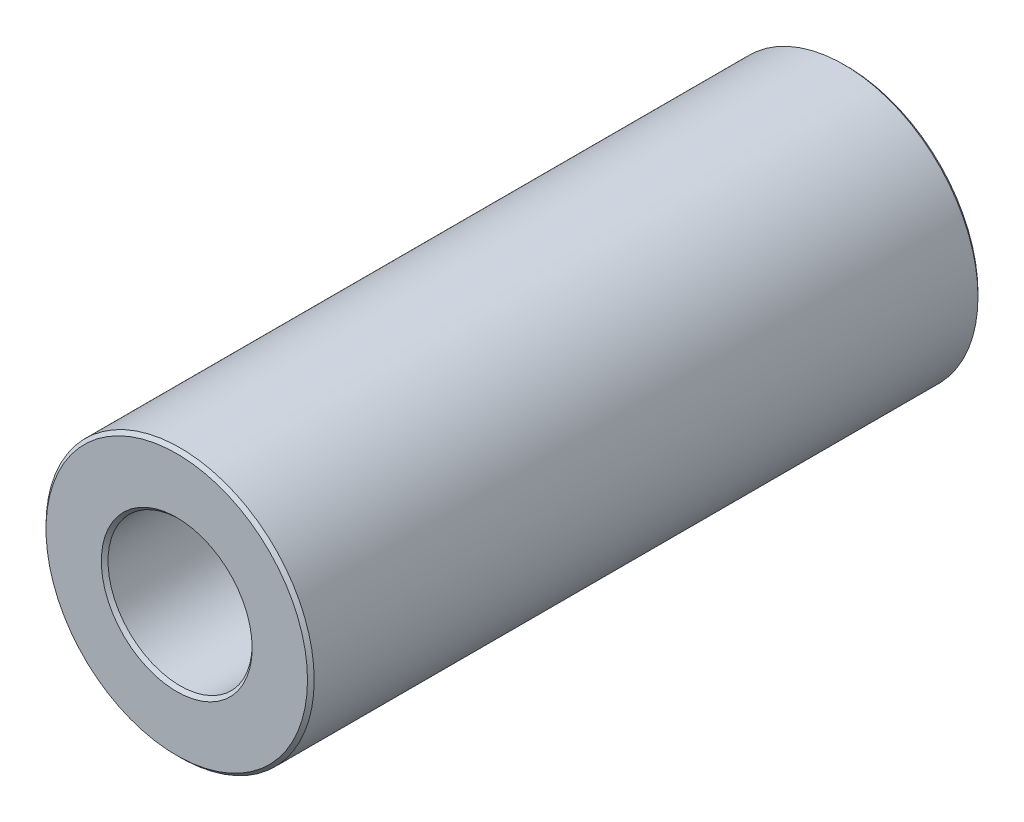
SolidWorks part; units mm, degrees
ref_plane "Front Plane" through (0, 0, 0) normal (0, 0, 1) x (1, 0, 0)
ref_plane "Top Plane" through (0, 0, 0) normal (0, 1, 0) x (1, 0, 0)
ref_plane "Right Plane" through (0, 0, 0) normal (1, 0, 0) x (0, 0, -1)
sketch "Sketch1" plane through (0, 0, 0) normal (0, 0, 1) x (1, 0, 0)
  circle A0 centre (0, 0) radius 4
  circle A1 centre (0, 0) radius 2.15
  dimension "D1" = 8
  dimension "D2" = 4.3
extrude "Boss-Extrude2" add sketch "Sketch1" along normal mid plane 20
chamfer "Chamfer3" distance 0.1 angle 45 4 edges at (4, 0, 10) (4, 0, -10) (2.15, 0, -10) (2.15, 0, 10)
